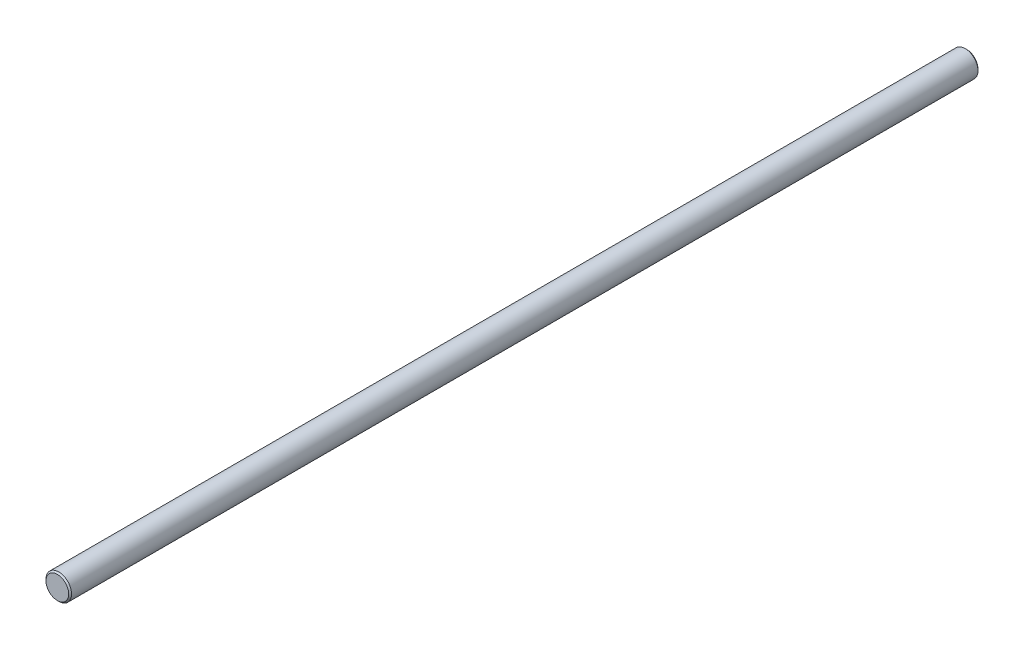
SolidWorks part; units mm, degrees
ref_plane "Спереди" through (0, 0, 0) normal (0, 0, 1) x (1, 0, 0)
ref_plane "Сверху" through (0, 0, 0) normal (0, 1, 0) x (1, 0, 0)
ref_plane "Справа" through (0, 0, 0) normal (1, 0, 0) x (0, 0, -1)
sketch "Эскиз1" plane through (0, 0, 0) normal (0, 0, 1) x (1, 0, 0)
  circle A0 centre (0, 0) radius 4.5
  dimension "D1" = 9
extrude "Бобышка-Вытянуть1" add sketch "Эскиз1" along normal mid plane 320
chamfer "Фаска1" distance 0.5 angle 45 2 edges at (4.5, 0, -160) (4.5, 0, 160)
